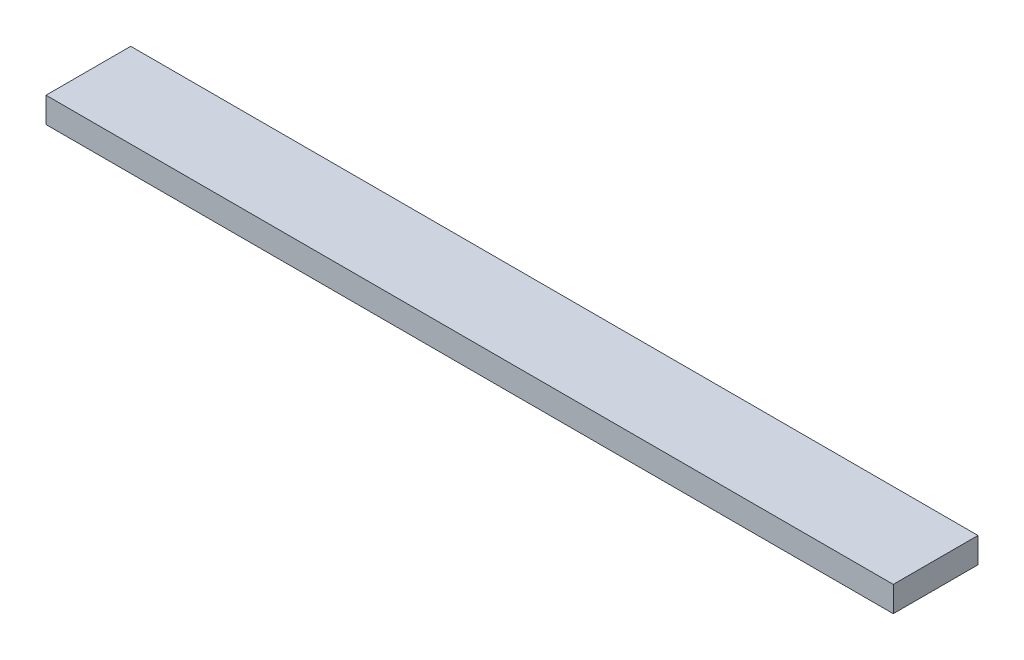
SolidWorks part; units mm, degrees
ref_plane "Ebene vorne" through (0, 0, 0) normal (0, 0, 1) x (1, 0, 0)
ref_plane "Ebene oben" through (0, 0, 0) normal (0, 1, 0) x (1, 0, 0)
ref_plane "Ebene rechts" through (0, 0, 0) normal (1, 0, 0) x (0, 0, -1)
sketch "Skizze1" plane through (0, 0, 0) normal (1, 0, 0) x (0, 0, -1)
  line L1 (0, 0) -> (50, 0)
  line L2 (0, 0) -> (0, 15)
  line L3 (0, 15) -> (50, 15)
  line L4 (50, 0) -> (50, 15)
  dimension "D1" = 50
  dimension "D2" = 15
extrude "Linear austragen1" add sketch "Skizze1" along normal blind 500
